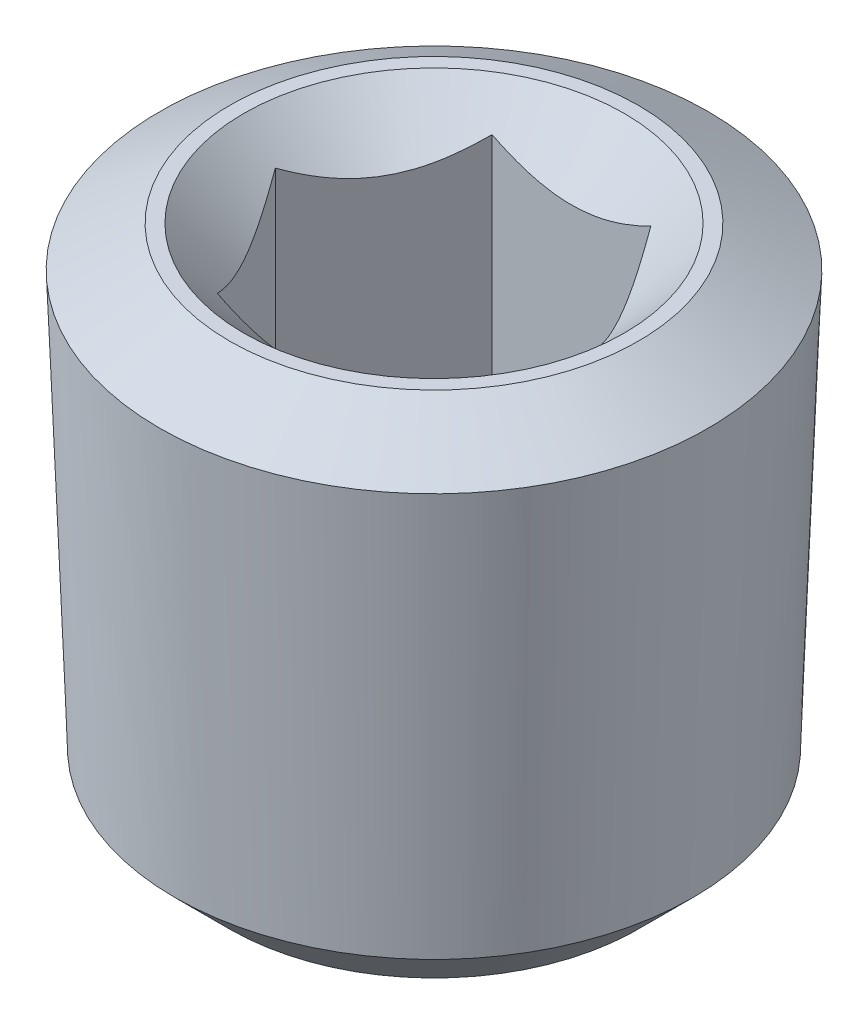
SolidWorks part; units mm, degrees
ref_plane "Front Plane" through (0, 0, 0) normal (0, 0, 1) x (1, 0, 0)
ref_plane "Top Plane" through (0, 0, 0) normal (0, 1, 0) x (1, 0, 0)
ref_plane "Right Plane" through (0, 0, 0) normal (1, 0, 0) x (0, 0, -1)
sketch "Sketch2" plane through (0, 0, 0) normal (0, 0, 1) x (1, 0, 0)
  line L0 (0, 10.7443) -> (0, -17.0657) construction
  line L1 (0, 0) -> (-2.9455, 0)
  line L2 (-3.9539, -0.5822) -> (-3.7363, -6.5498)
  line L3 (-2.9455, -7.3406) -> (0, -7.3406)
  line L4 (0, -7.3406) -> (0, 0)
  line L6 (-2.9455, -7.3406) -> (-3.7363, -6.5498)
  line L7 (-2.9455, 0) -> (-3.9539, -0.5822)
  point P4 (-3.9751, 0)
  point P6 (-3.7075, -7.3406)
  dimension "D1" = 7.3406
  dimension "D2" = 2.088
  dimension "D3" = 7.9502
  dimension "D4" = 30
  dimension "D5" = 0.762
  dimension "D6" = 45
revolve "Revolve1" add sketch "Sketch2" angle 360 about L0
sketch "Sketch3" plane through (0, 0, 0) normal (0, 0, 1) x (1, 0, 0)
  line L0 (0, 2.9342) -> (0, -8.1202) construction
  line L1 (0, 0) -> (-2.7432, 0)
  line L2 (2.9455, 0) -> (-2.9455, 0) construction
  line L3 (-1.9812, -0.762) -> (-1.9812, -6.096)
  line L4 (-1.9812, -6.096) -> (-1.5585, -6.35)
  line L5 (0, -6.35) -> (0, 0)
  line L6 (-1.9812, -0.762) -> (-2.7432, 0)
  line L7 (-1.5585, -6.35) -> (0, -6.35)
  dimension "D1" = 6.096
  dimension "D2" = 59
  dimension "D3" = 3.9624
  dimension "D4" = 0.762
  dimension "D5" = 45
  dimension "D6" = 6.35
revolve "Cut-Revolve1" cut sketch "Sketch3" angle 360 about L0
sketch "Sketch4" plane through (0, 0, 0) normal (0, 1, 0) x (1, 0, 0)
  line L1 (-1.1438, -1.9812) -> (1.1438, -1.9812)
  line L2 (1.1438, -1.9812) -> (2.2877, 0)
  line L3 (2.2877, 0) -> (1.1438, 1.9812)
  line L4 (1.1438, 1.9812) -> (-1.1438, 1.9812)
  line L5 (-1.1438, 1.9812) -> (-2.2877, 0)
  line L6 (-2.2877, 0) -> (-1.1438, -1.9812)
  circle A0 centre (0, 0) radius 1.9812 construction
  circle A1 centre (0, 0) radius 1.9812 construction
extrude "Cut-Extrude1" cut sketch "Sketch4" against normal up to vertex (5.2929 mm away)
